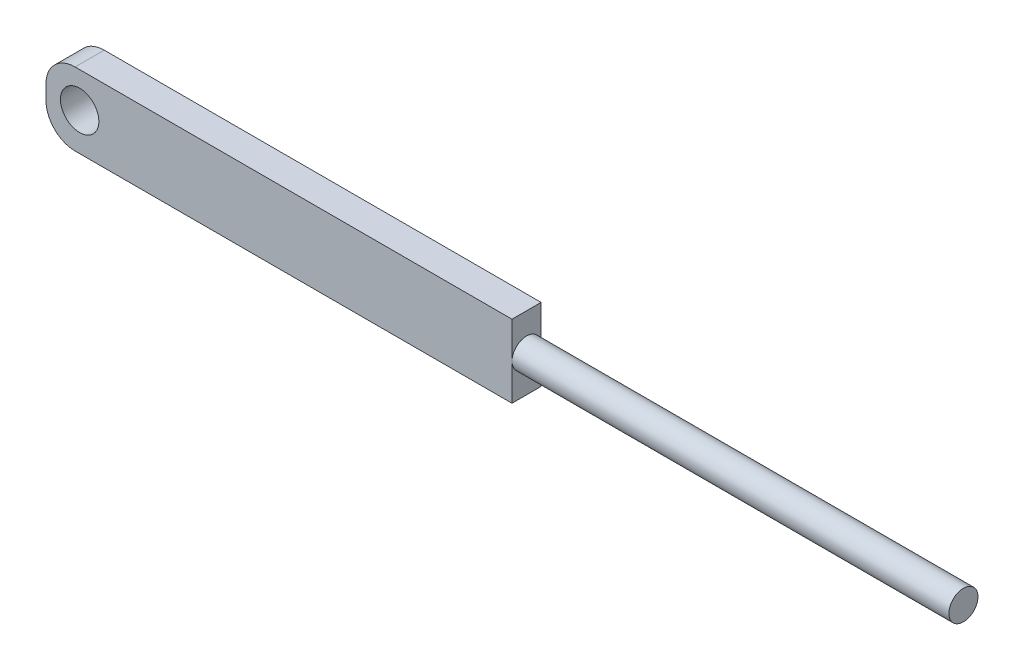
SolidWorks part; units mm, degrees
ref_plane "Front Plane" through (0, 0, 0) normal (0, 0, 1) x (1, 0, 0)
ref_plane "Top Plane" through (0, 0, 0) normal (0, 1, 0) x (1, 0, 0)
ref_plane "Right Plane" through (0, 0, 0) normal (1, 0, 0) x (0, 0, -1)
sketch "Sketch1" plane through (0, 0, 0) normal (0, 0, 1) x (1, 0, 0)
  line L1 (10, 0) -> (160, 0)
  line L2 (0, 10) -> (0, 15)
  line L3 (10, 25) -> (160, 25)
  line L4 (160, 0) -> (160, 25)
  arc A0 (10, 0) -> (0, 10) centre (10, 10) cw
  arc A1 (0, 15) -> (10, 25) centre (10, 15) cw
  point P7 (0, 0)
  dimension "D1" = 10
extrude "Boss-Extrude1" add sketch "Sketch1" along normal blind 10
sketch "Sketch2" plane through (160, 0, 0) normal (1, 0, 0) x (0, 0, -1)
  circle A0 centre (-5, 12.5) radius 5
extrude "Boss-Extrude2" add sketch "Sketch2" along normal blind 150
sketch "Sketch3" plane through (0, 0, 10) normal (0, 0, 1) x (1, 0, 0)
  circle A0 centre (11.5506, 12.8665) radius 6.5966
extrude "Cut-Extrude1" cut sketch "Sketch3" against normal blind 10
